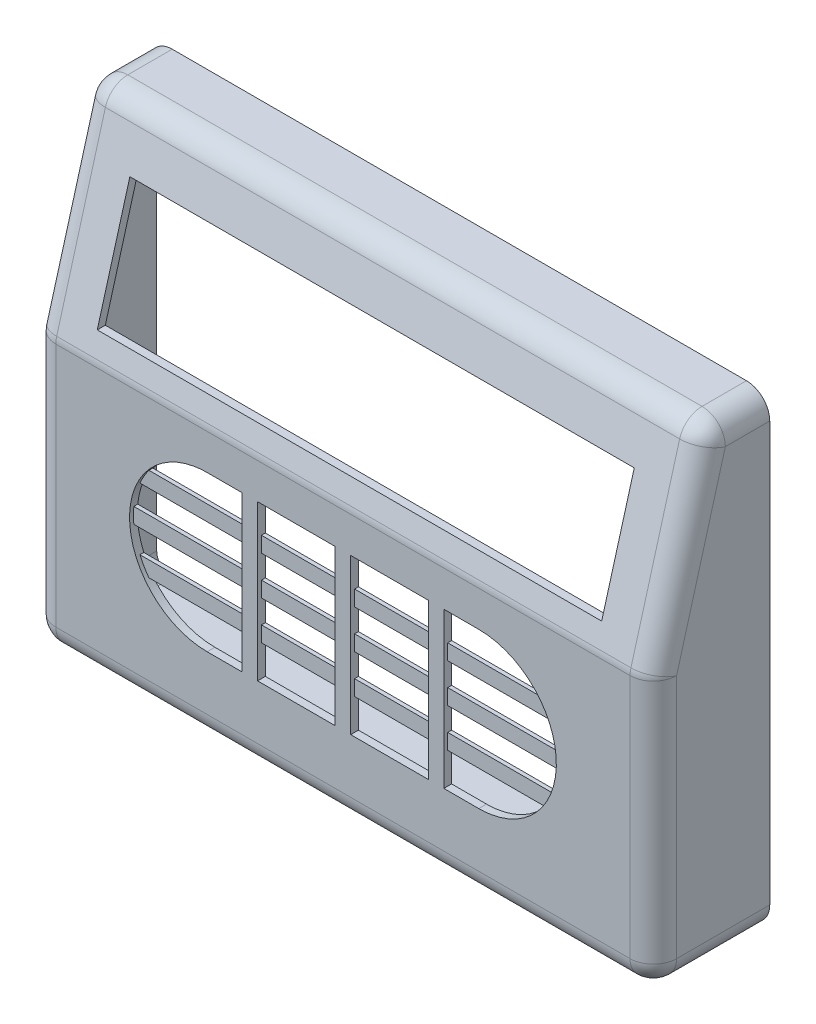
SolidWorks part; units mm, degrees
ref_plane "Front Plane" through (0, 0, 0) normal (0, 0, 1) x (1, 0, 0)
ref_plane "Top Plane" through (0, 0, 0) normal (0, 1, 0) x (1, 0, 0)
ref_plane "Right Plane" through (0, 0, 0) normal (1, 0, 0) x (0, 0, -1)
sketch "Sketch1" plane through (0, 0, 0) normal (1, 0, 0) x (0, 0, -1)
  line L0 (0, 0) -> (-15, 0)
  line L1 (-15, 0) -> (-15, 35)
  line L2 (-15, 35) -> (-8, 60)
  line L3 (-8, 60) -> (0, 60)
  line L4 (0, 60) -> (0, 0)
  dimension "D1" = 15
  dimension "D2" = 8
  dimension "D3" = 60
  dimension "D4" = 35
extrude "Extrude1" add sketch "Sketch1" along normal mid plane 80
fillet "Fillet1" radius 3 11 edges at (-40, 60, 4) (-40, 47.5, 11.5) (-40, 17.5, 15) (-40, 0, 7.5) (40, 47.5, 11.5) (40, 17.5, 15) (40, 0, 7.5) (0, 0, 15) (0, 35, 15) (0, 60, 8) (40, 60, 4)
shell "Shell1" thickness 1
ref_plane "Plane1" through (0, 0, 35) normal (0, 0, 1) x (1, 0, 0)
sketch "Sketch2" plane through (0, 0, 35) normal (0, 0, 1) x (1, 0, 0)
  line L0 (-17.5, 30) -> (17.5, 30)
  line L1 (17.5, 10) -> (-17.5, 10)
  line L2 (-12, 30) -> (-12, 10)
  line L4 (0, 30) -> (0, 10)
  line L5 (12, 30) -> (12, 10)
  line L6 (-26.1603, 25) -> (26.1603, 25)
  line L7 (-27.5, 20) -> (27.5, 20)
  line L8 (-26.1603, 15) -> (26.1603, 15)
  arc A0 (17.5, 30) -> (17.5, 10) centre (17.5, 20) cw
  arc A1 (-17.5, 10) -> (-17.5, 30) centre (-17.5, 20) cw
  point P5 (0, 10)
  dimension "D1" = 10
  dimension "D2" = 10
  dimension "D3" = 35
  dimension "D4" = 12
  dimension "D5" = 12
  dimension "D6" = 5
  dimension "D7" = 5
other "Vent1" parameters "RibsDepth"=1, "RibsWidth"=2, "RibsOffset"=0, "SparsDepth"=0.5, "SparsWidth"=2, "SparsOffset"=0.5, "D7"=1, "D8"=0, "Draft"=1
sketch "Sketch3" plane through (0, 0, 35) normal (0, 0, 1) x (1, 0, 0)
  line L0 (-40, 3) -> (-40, 34.5879) construction
  line L1 (-32.5, 53) -> (32.5, 53)
  line L2 (-32.5, 53) -> (-32.5, 38)
  line L3 (-32.5, 38) -> (32.5, 38)
  line L4 (32.5, 53) -> (32.5, 38)
  line L6 (-37, 60) -> (37, 60) construction
  dimension "D1" = 7.5
  dimension "D2" = 65
  dimension "D3" = 15
  dimension "D4" = 7
other "Vent2" parameters "D1"=1, "D2"=5, "D3"=0, "D4"=1, "D5"=2, "D6"=0, "D7"=1, "D8"=0, "D9"=1
